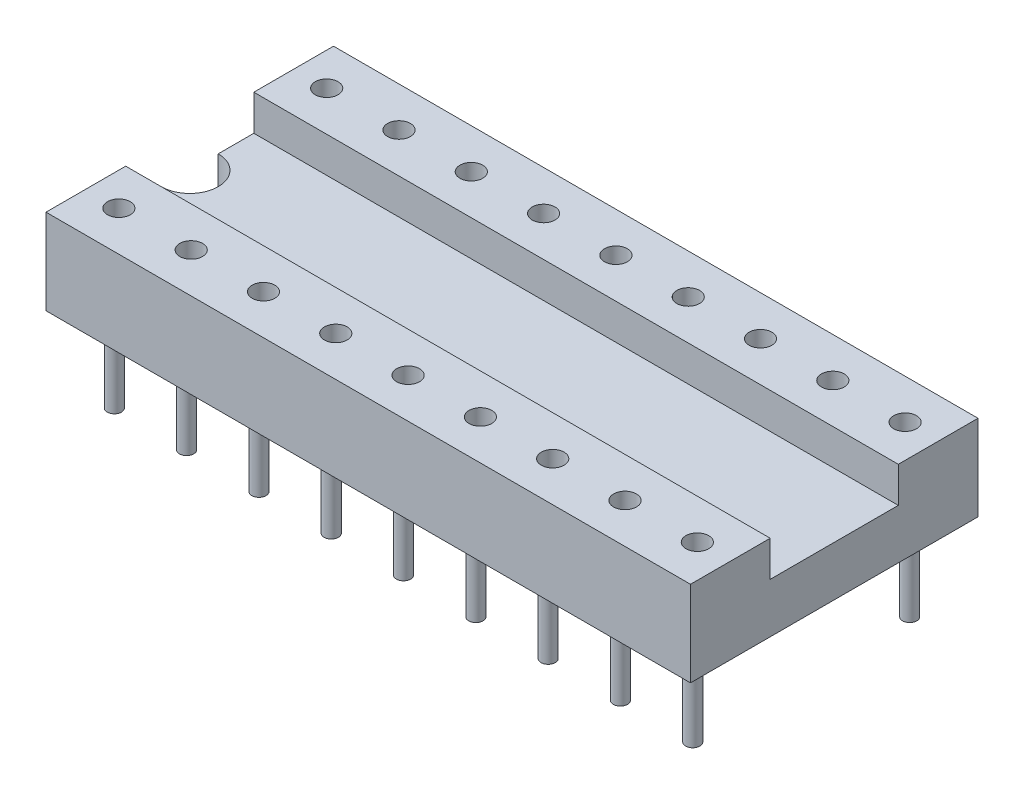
SolidWorks part; units mm, degrees
ref_plane "Plan de face" through (0, 0, 0) normal (0, 0, 1) x (1, 0, 0)
ref_plane "Plan de dessus" through (0, 0, 0) normal (0, 1, 0) x (1, 0, 0)
ref_plane "Plan de droite" through (0, 0, 0) normal (1, 0, 0) x (0, 0, -1)
sketch "Esquisse1" plane through (0, 0, 0) normal (1, 0, 0) x (0, 0, -1)
  line L0 (12.2051, 0) -> (-23.3437, 0) construction
  line L1 (0, -4.6214) -> (0, 25.9507) construction
  line L2 (-5.7968, 1.75) -> (2.763, 1.75) construction
  line L3 (5.7565, 3) -> (-6.8307, 3) construction
  line L4 (5.05, 3.8077) -> (5.05, -1.0493) construction
  line L5 (-5.05, 3.7235) -> (-5.05, -1.0493) construction
  line L6 (-2.25, 3.5071) -> (-2.25, 0.8142) construction
  line L7 (2.25, 3.5071) -> (2.25, 0.8142) construction
  line L8 (-2.25, 1.75) -> (-2.25, 3)
  line L9 (-2.25, 3) -> (-5.05, 3)
  line L10 (-5.05, 3) -> (-5.05, 0)
  line L11 (-5.05, 0) -> (5.05, 0)
  line L12 (5.05, 0) -> (5.05, 3)
  line L13 (5.05, 3) -> (2.25, 3)
  line L14 (2.25, 3) -> (2.25, 1.75)
  line L15 (2.25, 1.75) -> (-2.25, 1.75)
  dimension "D1" = 1.75
  dimension "D2" = 3
  dimension "D3" = 5.05
  dimension "D4" = 5.05
  dimension "D5" = 2.8
  dimension "D6" = 2.8
extrude "Extrusion1" add sketch "Esquisse1" along normal blind 22.64
sketch "Esquisse2" plane through (0, 1.75, 0) normal (0, 1, 0) x (-1, 0, 0)
  line L0 (0, -1) -> (0, 1)
  arc A0 (0, 1) -> (0, -1) centre (0, 0) ccw
extrude "Enlèv. mat.-Extru.1" cut sketch "Esquisse2" against normal through all
sketch "Esquisse3" plane through (0, 3, 0) normal (0, 1, 0) x (-1, 0, 0)
  line L0 (-13.1576, 5.05) -> (2.3638, 5.05) construction
  line L1 (0, 6.1465) -> (0, -6.3771) construction
  line L2 (1.5124, 0) -> (-12.9979, 0) construction
  line L3 (1.0512, 3.65) -> (-15.6055, 3.65) construction
  line L4 (-1.16, 6.2884) -> (-1.16, 1.7827) construction
  circle A0 centre (-1.16, 3.65) radius 0.4
  circle A1 centre (-1.16, -3.65) radius 0.4
  circle A2 centre (-3.7, 3.65) radius 0.4
  circle A3 centre (-3.7, -3.65) radius 0.4
  circle A4 centre (-6.24, 3.65) radius 0.4
  circle A5 centre (-6.24, -3.65) radius 0.4
  circle A6 centre (-8.78, 3.65) radius 0.4
  circle A7 centre (-8.78, -3.65) radius 0.4
  circle A8 centre (-11.32, 3.65) radius 0.4
  circle A9 centre (-11.32, -3.65) radius 0.4
  circle A10 centre (-13.86, 3.65) radius 0.4
  circle A11 centre (-13.86, -3.65) radius 0.4
  circle A12 centre (-16.4, 3.65) radius 0.4
  circle A13 centre (-16.4, -3.65) radius 0.4
  circle A14 centre (-18.94, 3.65) radius 0.4
  circle A15 centre (-18.94, -3.65) radius 0.4
  circle A16 centre (-21.48, 3.65) radius 0.4
  circle A17 centre (-21.48, -3.65) radius 0.4
  dimension "D1" = 1.4
  dimension "D2" = 1.16
extrude "Enlèv. mat.-Extru.2" cut sketch "Esquisse3" against normal blind 2.5
sketch "Esquisse5" plane through (0, 0, 0) normal (0, -1, 0) x (1, 0, 0)
  line L0 (-0.4263, 0) -> (10.6481, 0) construction
  circle A0 centre (1.16, 3.81) radius 0.25
  circle A1 centre (1.16, -3.81) radius 0.25
  circle A2 centre (3.7, -3.81) radius 0.25
  circle A3 centre (3.7, 3.81) radius 0.25
  circle A4 centre (6.24, -3.81) radius 0.25
  circle A5 centre (6.24, 3.81) radius 0.25
  circle A6 centre (8.78, -3.81) radius 0.25
  circle A7 centre (8.78, 3.81) radius 0.25
  circle A8 centre (11.32, -3.81) radius 0.25
  circle A9 centre (11.32, 3.81) radius 0.25
  circle A10 centre (13.86, -3.81) radius 0.25
  circle A11 centre (13.86, 3.81) radius 0.25
  circle A12 centre (16.4, -3.81) radius 0.25
  circle A13 centre (16.4, 3.81) radius 0.25
  circle A14 centre (18.94, -3.81) radius 0.25
  circle A15 centre (18.94, 3.81) radius 0.25
  circle A16 centre (21.48, -3.81) radius 0.25
  circle A17 centre (21.48, 3.81) radius 0.25
  dimension "D1" = 3.81
extrude "Extrusion2" add sketch "Esquisse5" along normal blind 3
